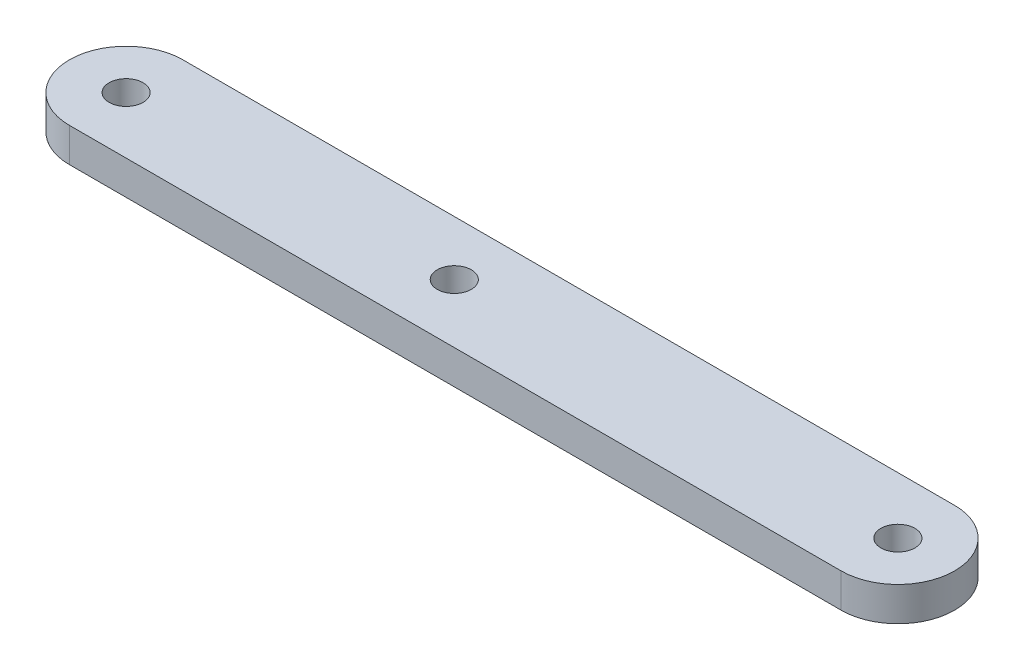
SolidWorks part; units mm, degrees
ref_plane "Front Plane" through (0, 0, 0) normal (0, 0, 1) x (1, 0, 0)
ref_plane "Top Plane" through (0, 0, 0) normal (0, 1, 0) x (1, 0, 0)
ref_plane "Right Plane" through (0, 0, 0) normal (1, 0, 0) x (0, 0, -1)
sketch "Sketch1" plane through (0, 0, 0) normal (0, 1, 0) x (1, 0, 0)
  line L0 (-34, 0) -> (34, 0) construction
  line L1 (-34, 5) -> (34, 5)
  line L2 (-34, -5) -> (34, -5)
  circle A0 centre (-34, 0) radius 1.5
  circle A1 centre (34, 0) radius 1.5
  arc A2 (-34, 5) -> (-34, -5) centre (-34, 0) ccw
  arc A3 (34, -5) -> (34, 5) centre (34, 0) ccw
  point P4 (0, 0)
  dimension "D1" = 3
  dimension "D2" = 5
  dimension "3" = 3
  dimension "D3" = 68
  dimension "D4" = 34
extrude "Boss-Extrude1" add sketch "Sketch1" along normal blind 3
sketch "Sketch3" plane through (0, 0, 0) normal (0, -1, 0) x (-1, 0, 0)
  circle A0 centre (5.2713, 0.1849) radius 1.5
  circle A1 centre (34, 0) radius 1.5 construction
  circle A2 centre (-34, 0) radius 1.5 construction
  dimension "D2" = 39.2713
  dimension "D1" = 28.7287
extrude "Cut-Extrude1" cut sketch "Sketch3" against normal blind 3
